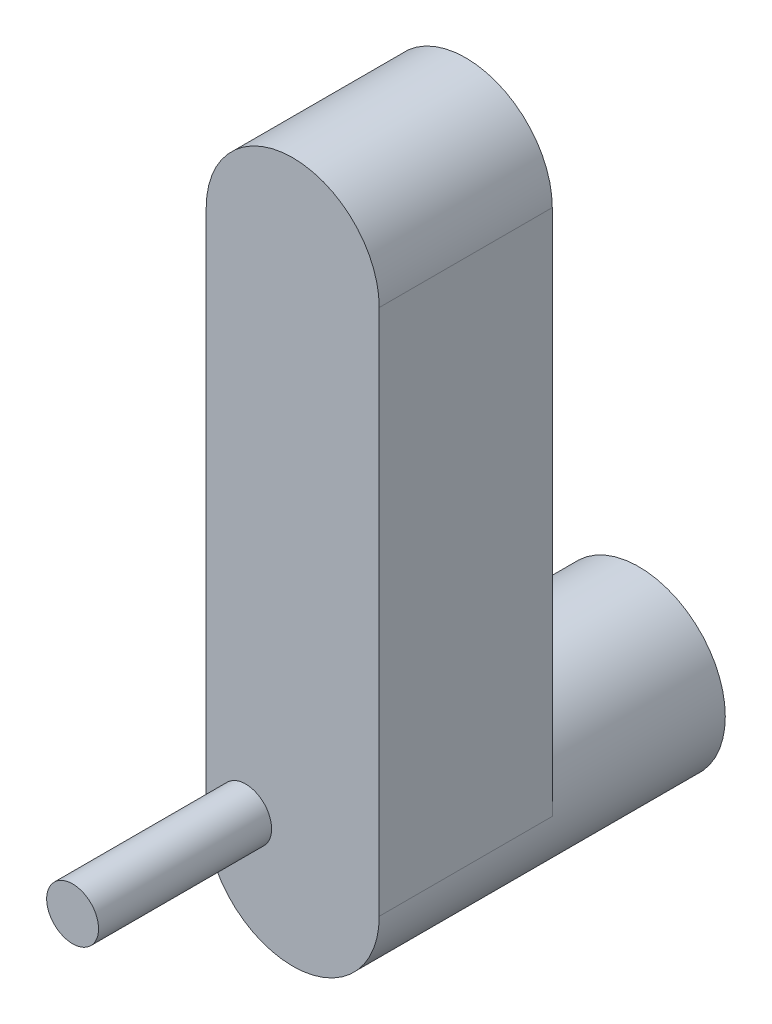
SolidWorks part; units mm, degrees
ref_plane "Front Plane" through (0, 0, 0) normal (0, 0, 1) x (1, 0, 0)
ref_plane "Top Plane" through (0, 0, 0) normal (0, 1, 0) x (1, 0, 0)
ref_plane "Right Plane" through (0, 0, 0) normal (1, 0, 0) x (0, 0, -1)
sketch "Sketch1" plane through (0, 0, 0) normal (0, 0, 1) x (1, 0, 0)
  circle A0 centre (0, 0) radius 5
  dimension "D1" = 10
extrude "Boss-Extrude1" add sketch "Sketch1" along normal blind 20
ref_plane "Plane1" through (0, 0, 10) normal (0, 0, 1) x (1, 0, 0)
sketch "Sketch2" plane through (0, 0, 10) normal (0, 0, 1) x (1, 0, 0)
  line L0 (0, 0) -> (0, 30.4696) construction
  line L1 (-5, 0) -> (-5, 30.4696)
  line L2 (5, 0) -> (5, 30.4696)
  arc A0 (-5, 0) -> (5, 0) centre (0, 0) ccw
  arc A1 (5, 30.4696) -> (-5, 30.4696) centre (0, 30.4696) ccw
  circle A2 centre (0, 0) radius 5 construction
  point P3 (0, 15.2348)
extrude "Boss-Extrude2" add sketch "Sketch2" along normal blind 10
sketch "Sketch3" plane through (0, 0, 20) normal (0, 0, 1) x (1, 0, 0)
  circle A0 centre (-2.7219, 1.2615) radius 1.5
  arc A1 (-5, 0) -> (5, 0) centre (0, 0) ccw construction
  arc A2 (-5, 0) -> (5, 0) centre (0, 0) ccw
  point P5 (-1.8568, 2.3563)
  point P6 (-2.7219, 1.2615)
  dimension "D2" = 3
  dimension "D1" = 3
extrude "Boss-Extrude3" add sketch "Sketch3" along normal blind 10 contours A0
